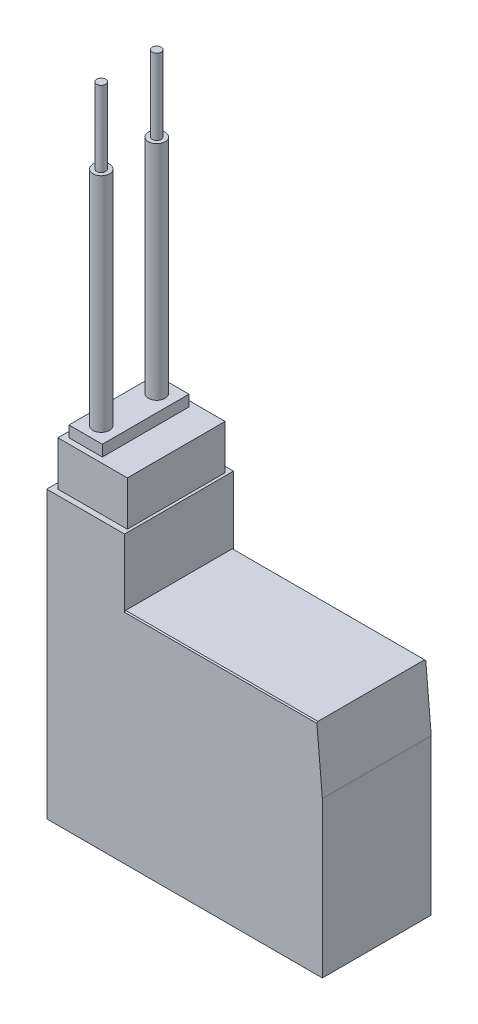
SolidWorks part; units mm, degrees
ref_plane "Plane1" through (0, 0, 0) normal (0, 0, 1) x (1, 0, 0)
ref_plane "Plane2" through (0, 0, 0) normal (0, 1, 0) x (1, 0, 0)
ref_plane "Plane3" through (0, 0, 0) normal (1, 0, 0) x (0, 0, -1)
sketch "Sketch1" plane through (0, 0, 0) normal (0, 0, 1) x (1, 0, 0)
  line L0 (24.3, 19.7) -> (24.8, 13.985)
  line L1 (0, 0) -> (24.8, 0)
  line L2 (0, 0) -> (0, 19.7)
  line L3 (0, 19.7) -> (24.3, 19.7)
  line L4 (24.8, 0) -> (24.8, 13.985)
  dimension "D1" = 19.7
  dimension "D2" = 24.8
  dimension "D3" = 95
  dimension "D4" = 0.5
extrude "Base-Extrude" add sketch "Sketch1" against normal mid plane 9.8
sketch "Sketch2" plane through (0, 0, 4.9) normal (0, 0, 1) x (1, 0, 0)
  line L1 (0, 19.7) -> (7, 19.7)
  line L2 (0, 19.7) -> (0, 25.7)
  line L3 (0, 25.7) -> (7, 25.7)
  line L4 (7, 19.7) -> (7, 25.7)
  dimension "D1" = 7
  dimension "D2" = 6
extrude "L type1" add sketch "Sketch2" against normal up to surface (9.8 mm away)
sketch "Sketch3" plane through (0, 25.7, 0) normal (0, 1, 0) x (-1, 0, 0)
  line L0 (-7, -4.9) -> (-7, 4.9) construction
  line L1 (-0.5, 4.4) -> (-6.75, 4.4)
  line L2 (-0.5, 4.4) -> (-0.5, -4.4)
  line L3 (-0.5, -4.4) -> (-6.75, -4.4)
  line L4 (-6.75, 4.4) -> (-6.75, -4.4)
  line L5 (0, -4.9) -> (0, 4.9) construction
  line L6 (-7, -4.9) -> (0, -4.9) construction
  line L7 (-7, 4.9) -> (0, 4.9) construction
  dimension "D1" = 0.25
  dimension "D2" = 0.5
  dimension "D3" = 0.5
  dimension "D4" = 0.5
extrude "L type2" add sketch "Sketch3" along normal blind 4
sketch "Sketch4" plane through (0, 29.7, 0) normal (0, 1, 0) x (-1, 0, 0)
  line L0 (-0.5, -4.4) -> (-0.5, 4.4) construction
  line L1 (-1, -3.9) -> (-4, -3.9)
  line L2 (-1, -3.9) -> (-1, 3.9)
  line L3 (-1, 3.9) -> (-4, 3.9)
  line L4 (-4, -3.9) -> (-4, 3.9)
  line L5 (-6.75, -4.4) -> (-0.5, -4.4) construction
  line L6 (-0.5, 4.4) -> (-6.75, 4.4) construction
  dimension "D1" = 0.5
  dimension "D2" = 3
  dimension "D3" = 0.5
  dimension "D4" = 0.5
extrude "L type3" add sketch "Sketch4" along normal blind 1
sketch "Sketch5" plane through (0, 30.7, 0) normal (0, 1, 0) x (-1, 0, 0)
  line L0 (-4, 0) -> (4.0574, 0) construction
  line L1 (-4, 3.9) -> (-4, -3.9) construction
  line L2 (-2.5, -3.9) -> (-2.5, -2.5117) construction
  line L3 (-4, -3.9) -> (-1, -3.9) construction
  circle A0 centre (-2.5, -2.5) radius 0.75
  circle A1 centre (-2.5, 2.5) radius 0.75
  dimension "D2" = 1.5
  dimension "D1" = 2.5
extrude "L type4" add sketch "Sketch5" along normal blind 20
sketch "Sketch6" plane through (0, 50.7, 0) normal (0, 1, 0) x (-1, 0, 0)
  circle A0 centre (-2.5, 2.5) radius 0.4
  circle A2 centre (-2.5, -2.5) radius 0.4
  dimension "D1" = 0.8
extrude "L type5" add sketch "Sketch6" along normal blind 6.8
chamfer "Chamfer1" distance 0.1 angle 45
